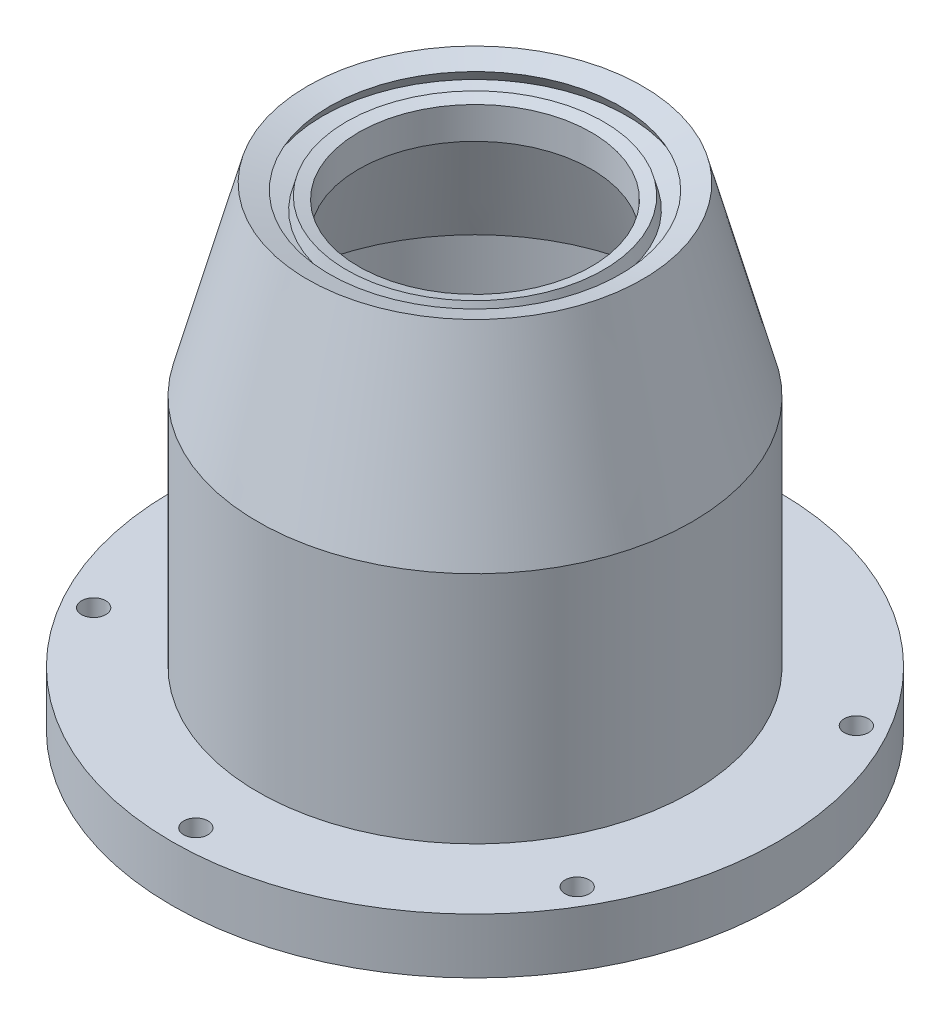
SolidWorks part; units mm, degrees
ref_plane "Front" through (0, 0, 0) normal (0, 0, 1) x (1, 0, 0)
ref_plane "Top" through (0, 0, 0) normal (0, 1, 0) x (1, 0, 0)
ref_plane "Right" through (0, 0, 0) normal (1, 0, 0) x (0, 0, -1)
sketch "Sketch1" plane through (0, 0, 0) normal (0, 0, 1) x (1, 0, 0)
  line L0 (0, 0) -> (0, -190.5) construction
  line L1 (-60.325, -190.5) -> (0, -190.5) construction
  line L2 (-60.325, -190.5) -> (-60.325, -179.4949)
  line L3 (-60.325, -179.4949) -> (-43.2109, -179.4949)
  line L4 (0, -101.6) -> (-3.3962, -114.2747) construction
  line L5 (-23.1521, -105.3087) -> (-32.5223, -105.3087)
  line L6 (-43.2109, -132.932) -> (-33.3375, -96.0838)
  line L7 (-33.3375, -96.0838) -> (-28.9523, -97.3875)
  line L11 (-32.5223, -105.3087) -> (-40.0359, -133.35)
  line L12 (-60.325, -190.5) -> (-48.9894, -190.5)
  line L13 (-44.7984, -190.5) -> (-40.0359, -190.5)
  line L14 (0, 0) -> (-26.9503, -100.5798) construction
  line L15 (-28.9523, -97.3875) -> (-30.2802, -99.6876)
  line L16 (-30.2802, -99.6876) -> (-26.232, -100.7723)
  line L17 (-26.232, -100.7723) -> (-25.577, -98.3279)
  line L18 (-25.577, -98.3279) -> (-23.1521, -98.9587)
  line L19 (-48.9894, -190.5) -> (-48.9894, -184.15)
  line L20 (-44.7984, -190.5) -> (-44.7984, -184.15)
  line L21 (-48.9894, -184.15) -> (-44.7984, -184.15)
  line L22 (-43.2109, -132.932) -> (-43.2109, -179.4949)
  line L23 (-40.0359, -133.35) -> (-40.0359, -190.5)
  line L24 (-40.0359, -133.35) -> (0, -133.35) construction
  line L26 (-23.1521, -98.9587) -> (-23.1521, -105.3087)
  circle A0 centre (0, 0) radius 101.6 construction
  dimension "D3" = 2.5654
  dimension "D4" = 51.1048
  dimension "D5" = 46.3042
  dimension "D6" = 4.191
  dimension "D7" = 6.35
  dimension "D8" = 3.175
  dimension "D9" = 3.175
  dimension "D10" = 190.5
  dimension "D11" = 75
  dimension "D12" = 133.35
  dimension "D19" = 4.7625
  dimension "D22" = 15
  dimension "D25" = 66.675
revolve "Revolve1" add sketch "Sketch1" angle 360 about L0
hole_wizard "#10-32 Tapped Hole1" positions "Sketch3" profile "Sketch2" tap size "#10-32" standard "Ansi Inch"
sketch "Sketch3" plane through (0, -190.5, 0) normal (0, -1, 0) x (1, 0, 0)
  line L0 (48.1185, 27.7813) -> (0, 0)
  line L1 (0, 0) -> (0, 55.5625)
  line L2 (0, 0) -> (0, 73.0119)
  circle A0 centre (0, 0) radius 55.5625
  point P0 (0, 55.5625)
  point P18 (48.1185, 27.7813)
  point P19 (48.1185, -27.7812)
  point P20 (0, -55.5625)
  point P21 (-48.1185, -27.7812)
  point P22 (-48.1185, 27.7813)
  dimension "D1" = 111.125
  dimension "D2" = 60
  dimension "D3" = 0
sketch "Sketch2" plane through (0, -190.5, 55.5625) normal (1, 0, 0) x (0, 0, -1)
  line L0 (0, 0) -> (0, 94.4162)
  line L1 (0, 94.4162) -> (2.413, 94.4162)
  line L2 (2.413, 94.4162) -> (2.413, 0)
  line L5 (2.413, 0) -> (0, 0)
  line L11 (0, -6.35) -> (0, 107.95) construction
  dimension "Thread Major Dia." = 4.826
  dimension "Thru Tap Drill Depth" = 94.4162
